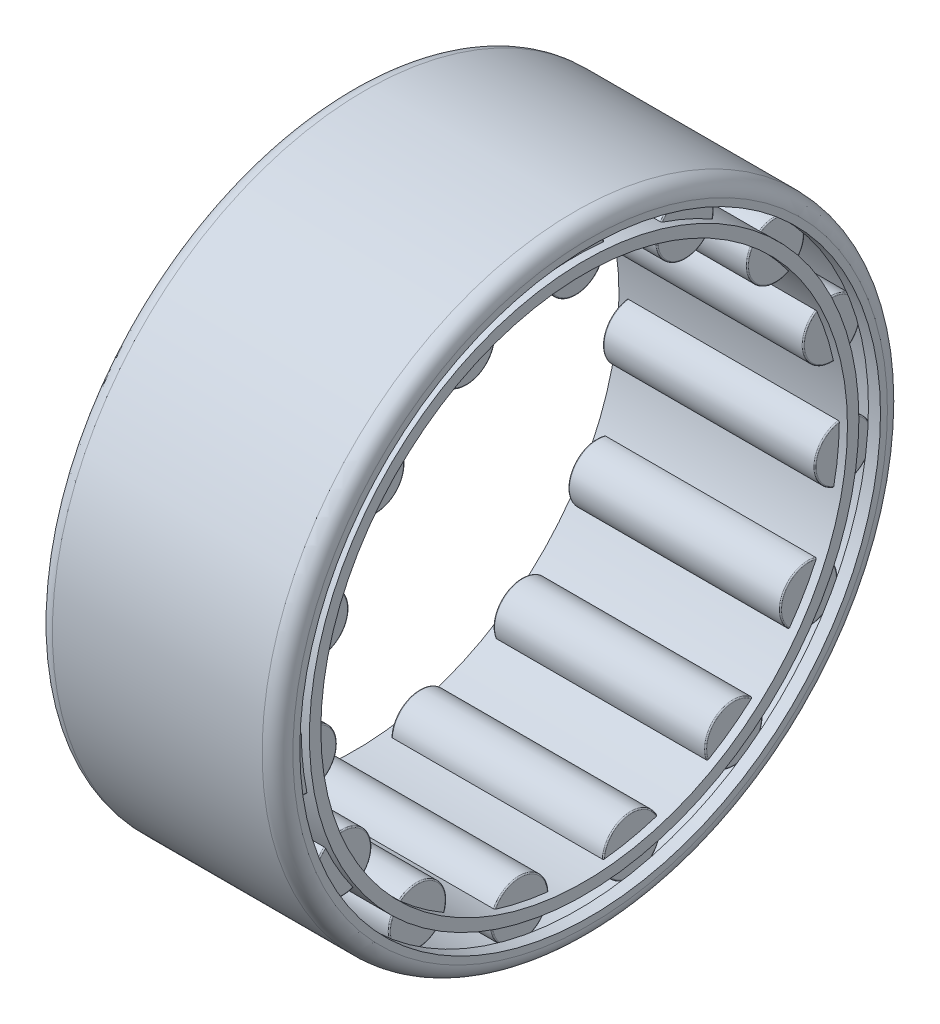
SolidWorks part; units mm, degrees
ref_plane "Plane1" through (0, 0, 0) normal (0, 0, 1) x (1, 0, 0)
ref_plane "Plane2" through (0, 0, 0) normal (0, 1, 0) x (1, 0, 0)
ref_plane "Plane3" through (0, 0, 0) normal (1, 0, 0) x (0, 0, -1)
sketch "Clipboard" plane through (0, 0, 0) normal (0, 0, 1) x (1, 0, 0)
  line L0 (-10, 0) -> (10, 0) construction
  line L1 (41.1529, 1.4371) -> (62.7517, -4.3503)
  line L2 (41.1529, 1.4371) -> (75.4583, 10.6292)
  line L3 (41.1529, 1.4371) -> (62.7517, -4.3503)
  line L4 (41.1529, 1.4371) -> (-22.3471, -0.7804)
  dimension "BallCLRad" = 35.5155
  dimension "Count" = 15
  dimension "Show_count" = 15
  dimension "Max_count" = 15
  dimension "Min_count" = 2
  dimension "Bore" = 63.5
sketch "InnRacSke" plane through (0, 0, 0) normal (0, 0, 1) x (1, 0, 0)
  line L0 (-14.2875, 38.3286) -> (-15.875, 38.3286)
  line L1 (-15.875, 38.3286) -> (-15.875, 39.243)
  line L2 (-13.843, 41.275) -> (13.843, 41.275)
  line L4 (15.875, 39.243) -> (15.875, 38.3286)
  line L5 (15.875, 38.3286) -> (14.2875, 38.3286)
  line L6 (14.2875, 38.3286) -> (14.2875, 39.2811)
  line L7 (14.2875, 39.2811) -> (-14.2875, 39.2811)
  line L8 (-14.2875, 39.2811) -> (-14.2875, 38.3286)
  line L9 (-31.75, 0) -> (31.75, 0) construction
  arc A0 (-15.875, 39.243) -> (-13.843, 41.275) centre (-13.843, 39.243) cw
  arc A2 (13.843, 41.275) -> (15.875, 39.243) centre (13.843, 39.243) cw
  dimension "radius" = 2.032
  dimension "D1" = 78.5622
  dimension "OD" = 82.55
  dimension "Width" = 31.75
  dimension "groove_dp" = 0.9525
  dimension "Cyl_Len" = 28.575
  dimension "halfCyl" = 14.2875
revolve "Race" add sketch "InnRacSke" angle 360 about L9
sketch "RolDetSke" plane through (0, 0, 0) normal (0, 0, 1) x (1, 0, 0)
  line L0 (-14.0018, 39.131) -> (-14.0017, 35.5155)
  line L1 (-14.0017, 35.5155) -> (14.0017, 35.5155)
  line L2 (14.0017, 35.5155) -> (14.0018, 39.131)
  line L3 (13.8511, 39.2816) -> (-13.8511, 39.2816)
  line L4 (-28.575, 35.5155) -> (28.575, 35.5155) construction
  arc A0 (14.0018, 39.131) -> (13.8511, 39.2816) centre (13.8511, 39.131) ccw
  arc A1 (-13.8511, 39.2816) -> (-14.0018, 39.131) centre (-13.8511, 39.131) ccw
  dimension "Roller_radius" = 0.1506
  dimension "Roller_diameter" = 7.5321
  dimension "Roller_length" = 28.0035
  dimension "RollerCLRad" = 35.5155
  dimension "halfLength" = 14.0017
revolve "RollerDetailed" add sketch "RolDetSke" angle 360 about L4
ref_axis "Axis1" through (-50, 0, 0) along (1, 0, 0)
sketch "CagSpiSke" plane through (0, 0, 0) normal (0, 0, 1) x (1, 0, 0)
  line L0 (15.0812, 34.7623) -> (15.0812, 36.2688)
  line L1 (15.0812, 36.2688) -> (-15.0813, 36.2688)
  line L2 (-15.0813, 36.2688) -> (-15.0813, 34.7623)
  line L3 (-15.0813, 34.7623) -> (15.0812, 34.7623)
  line L4 (-31.75, 0) -> (31.75, 0) construction
  dimension "Cage_width" = 30.1625
  dimension "D2" = 69.5247
  dimension "Cage_thickness" = 1.5064
  dimension "halfWidth" = 15.0813
revolve "CageSpine" add sketch "CagSpiSke" angle 360 about L4
pattern_circular "RollersDetailed" count 15 every 24 about axis through (-50, 0, 0) along (1, 0, 0) of "RollerDetailed"
sketch "RolSimSke" plane through (0, 0, 0) normal (0, 0, 1) x (1, 0, 0)
  line L0 (-25.4, 0) -> (25.4, 0) construction
  line L2 (-13.8511, 39.2821) -> (13.8511, 39.2821)
  line L3 (-14.0018, 39.1315) -> (-14.0018, 31.9006)
  line L4 (-13.8511, 31.75) -> (13.8511, 31.75)
  line L5 (14.0017, 39.1315) -> (14.0017, 31.9006)
  arc A0 (-14.0018, 31.9006) -> (-13.8511, 31.75) centre (-13.8511, 31.9006) ccw
  arc A1 (-13.8511, 39.2821) -> (-14.0018, 39.1315) centre (-13.8511, 39.1315) ccw
  arc A2 (14.0017, 39.1315) -> (13.8511, 39.2821) centre (13.8511, 39.1315) ccw
  arc A3 (13.8511, 31.75) -> (14.0017, 31.9006) centre (13.8511, 31.9006) ccw
  point P10 (-14.0018, 31.75)
  point P15 (14.0017, 39.2821)
  point P18 (14.0017, 31.75)
  dimension "D1" = 0.1506
  dimension "Bore" = 63.5
  dimension "Roller_length" = 28.0035
  dimension "Roller_diameter" = 7.5321
  dimension "halfWidth" = 14.0017
revolve "RollersSimplified" [suppressed] add sketch "RolSimSke" angle 360 about L0
equation "\"BallCLRad@Clipboard\" =  ( \"D1@InnRacSke\" + \"Bore@Clipboard\" )  / 4"
equation "\"RollerCLRad@RolDetSke\" = \"BallCLRad@Clipboard\""
equation "\"halfCyl@InnRacSke\" = \"Cyl_Len@InnRacSke\" / 2"
equation "\"Roller_diameter@RolDetSke\" =  ( \"D1@InnRacSke\" - \"Bore@Clipboard\" )  / 2 + .001"
equation "\"Roller_radius@RolDetSke\" = \"Roller_diameter@RolDetSke\" / 50"
equation "\"Roller_length@RolDetSke\" = \"Cyl_Len@InnRacSke\" * .98"
equation "\"halfLength@RolDetSke\" = \"Roller_length@RolDetSke\" / 2"
equation "\"Cage_width@CagSpiSke\" =  ( \"Cyl_Len@InnRacSke\" + \"Width@InnRacSke\" )  / 2"
equation "\"halfWidth@CagSpiSke\" = \"Cage_width@CagSpiSke\" / 2"
equation "\"Cage_thickness@CagSpiSke\"  = \"Roller_diameter@RolDetSke\" / 5"
equation "\"D2@CagSpiSke\" =  \"RollerCLRad@RolDetSke\" * 2 - \"Cage_thickness@CagSpiSke\""
equation "\"Roller_length@RolSimSke\" = \"Cyl_Len@InnRacSke\" * .98"
equation "\"halfWidth@RolSimSke\" = \"Roller_length@RolSimSke\" / 2"
equation "\"D1@RolSimSke\" = \"Roller_radius@RolDetSke\""
equation "\"Roller_diameter@RolSimSke\" =  ( \"D1@InnRacSke\" - \"Bore@Clipboard\" )  / 2 + .001"
equation "\"Max_count@Clipboard\" = int( 3.14159265 / atn(( \"Roller_diameter@RolDetSke\" / 2) / sqr( \"RollerCLRad@RolDetSke\"  *  \"RollerCLRad@RolDetSke\" - ( \"Roller_diameter@RolDetSke\" / 2) *  ( \"Roller_diameter@R"
equation "\"Max_count@Clipboard\" = ((sgn( \"Max_count@Clipboard\" - \"Count@Clipboard\" )-1)*( \"Max_count@Clipboard\" - \"Count@Clipboard\" ))/-2+ \"Count@Clipboard\""
equation "\"Count@RollersDetailed\" = int( \"Show_count@Clipboard\" ) "
equation "\"Count@RollersDetailed\" = ((sgn( \"Count@RollersDetailed\" - \"Max_count@Clipboard\" )-1)*( \"Count@RollersDetailed\" - \"Max_count@Clipboard\" ))/-2+ \"Max_count@Clipboard\""
equation "\"Count@RollersDetailed\" = ((sgn( \"Count@RollersDetailed\" - \"Min_count@Clipboard\" )+1)*( \"Count@RollersDetailed\" - \"Min_count@Clipboard\"))/2 +\"Min_count@Clipboard\""
equation "\"Angle@RollersDetailed\" = 360.0 / \"Max_count@Clipboard\""
equation "\"Angle@CageSpine\" =  \"Angle@RollersDetailed\" * ( \"Count@RollersDetailed\" -1 + int( \"Count@RollersDetailed\" / \"Max_count@Clipboard\" ) )  + 0.001 -  int( \"Count@RollersDetailed\" / \"Max_count@Clipboard\" "
equation "\"Angle@CageSpine\" =  \"Angle@CageSpine\" * int( \"Min_count@Clipboard\" / 2) + int(1 / \"Min_count@Clipboard\")  * 0.001"
equation "\"Bore@RolSimSke\" = \"Bore@Clipboard\""
